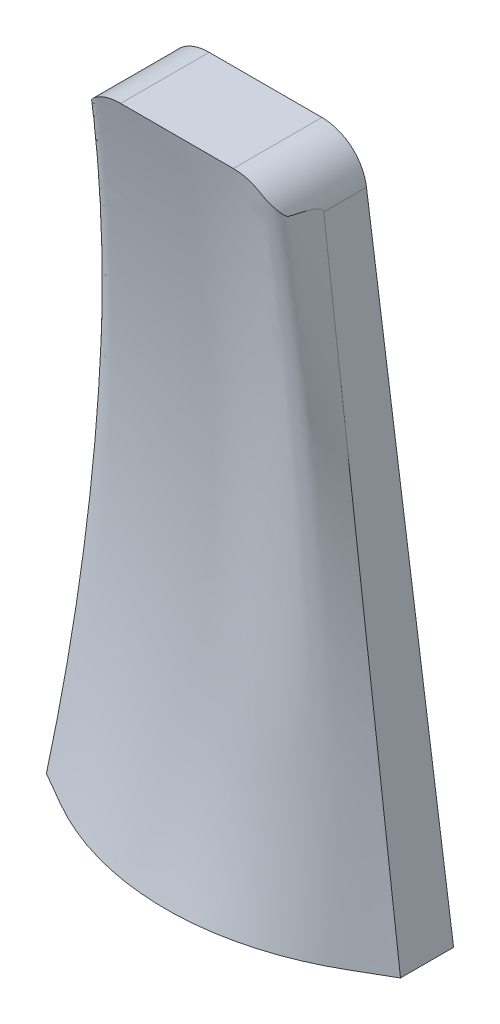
SolidWorks part; units mm, degrees
ref_plane "Front Plane" through (0, 0, 0) normal (0, 0, 1) x (1, 0, 0)
ref_plane "Top Plane" through (0, 0, 0) normal (0, 1, 0) x (1, 0, 0)
ref_plane "Right Plane" through (0, 0, 0) normal (1, 0, 0) x (0, 0, -1)
sketch "Sketch1" plane through (0, 0, 0) normal (0, 1, 0) x (1, 0, 0)
  line L0 (40, 0) -> (40, 12)
  line L1 (40, 12) -> (26.1436, 20)
  line L2 (26.1436, 20) -> (-26.1436, 20)
  line L3 (-40, 12) -> (-26.1436, 20)
  line L4 (-40, 0) -> (-40, 12)
  line L5 (40, 0) -> (32.5, -4.3301)
  line L6 (-40, 0) -> (-32.5, -4.3301)
  line L8 (0, 0) -> (0, 59.6227) construction
  line L9 (0, 0) -> (40, 0) construction
  arc A0 (-32.5, -4.3301) -> (32.5, -4.3301) centre (0, 51.9615) ccw
  point P5 (0, 20)
  point P13 (-40, 6)
  dimension "D6" = 65
  dimension "D1" = 30
  dimension "D2" = 80
  dimension "D3" = 20
  dimension "D4" = 12
  dimension "D5" = 120
sketch "Sketch3" plane through (0, 0, 0) normal (1, 0, 0) x (0, 0, -1)
  line L0 (9.511, 150) -> (20, 0)
  line L2 (0, 0) -> (59.6227, 0) construction
  dimension "D1" = 94
  dimension "D2" = 150
sketch "Sketch4" plane through (0, 0, 0) normal (1, 0, 0) x (0, 0, -1)
  line L0 (-4.3301, 0) -> (-13.0385, 0) construction
  arc A0 (-10.489, 150) -> (-13.0385, 0) centre (-302.1928, 79.9362) cw
  dimension "D1" = 300
  dimension "D2" = 20
sketch "Sketch5" plane through (0, 0, 0) normal (0, 0, 1) x (1, 0, 0)
  line L0 (40, 0) -> (21.5823, 150)
  line L1 (0, 0) -> (40, 0) construction
  line L2 (0, 150) -> (0, 0) construction
  dimension "D1" = 7
ref_plane "Plane1" through (-40, 0, -6) normal (0, 0, -1) x (-1, 0, 0)
sketch "Sketch6" plane through (-40, 0, -6) normal (0, 0, -1) x (-1, 0, 0)
  line L0 (-40, 150) -> (-40, 0) construction
  line L1 (-40, 150) -> (-40, 0)
ref_plane "Plane2" through (0, 150, 0) normal (0, 1, 0) x (-1, 0, 0)
sketch "Sketch7" plane through (0, 150, 0) normal (0, 1, 0) x (-1, 0, 0)
  line L1 (21.5823, -9.511) -> (-21.5823, -9.511)
  line L2 (21.5823, -9.511) -> (21.5823, 7.489)
  line L3 (18.5823, 10.489) -> (-18.5823, 10.489)
  line L4 (-21.5823, -9.511) -> (-21.5823, 7.489)
  arc A0 (21.5823, 7.489) -> (18.5823, 10.489) centre (18.5823, 7.489) ccw
  arc A1 (-18.5823, 10.489) -> (-21.5823, 7.489) centre (-18.5823, 7.489) ccw
  dimension "D1" = 3
loft "Loft2" add profiles "Sketch1", "Sketch7"
fillet "Fillet1" radius 10 5 edges
fillet "Fillet2" radius 10 4 edges
